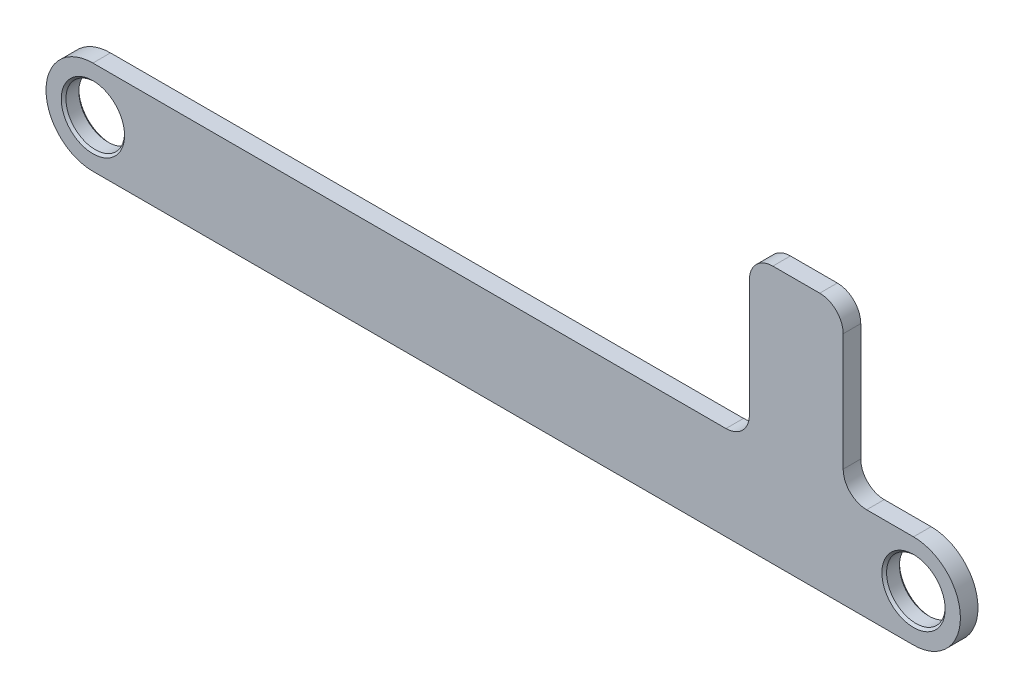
SolidWorks part; units mm, degrees
ref_plane "Plan de face" through (0, 0, 0) normal (0, 0, 1) x (1, 0, 0)
ref_plane "Plan de dessus" through (0, 0, 0) normal (0, 1, 0) x (1, 0, 0)
ref_plane "Plan de droite" through (0, 0, 0) normal (1, 0, 0) x (0, 0, -1)
sketch "Esquisse1" plane through (0, 0, 0) normal (0, 0, 1) x (1, 0, 0)
  line L0 (0, 0) -> (-70, 0) construction
  line L1 (-70, 4) -> (-14, 4)
  line L2 (-14, 18) -> (-6, 18)
  line L3 (-6, 18) -> (-6, 4)
  line L4 (-6, 4) -> (0, 4)
  line L5 (0, -4) -> (-70, -4)
  line L6 (-14, 4) -> (-14, 18)
  arc A0 (0, -4) -> (0, 4) centre (0, 0) ccw
  arc A1 (-70, 4) -> (-70, -4) centre (-70, 0) ccw
  circle A2 centre (-70, 0) radius 2.5
  circle A3 centre (0, 0) radius 2.5
  dimension "D1" = 5
  dimension "D2" = 4
  dimension "D3" = 70
  dimension "D5" = 6
  dimension "D4" = 8
  dimension "D6" = 22
extrude "Extrusion1" add sketch "Esquisse1" along normal mid plane 1.5
fillet "Congé1" radius 2 4 edges at (-14, 4, 0) (-6, 4, 0) (-6, 18, 0) (-14, 18, 0)
chamfer "Chanfrein1" distance 0.2 angle 45 4 edges at (2.5, 0, -0.75) (2.5, 0, 0.75) (-67.5, 0, -0.75) (-67.5, 0, 0.75)
